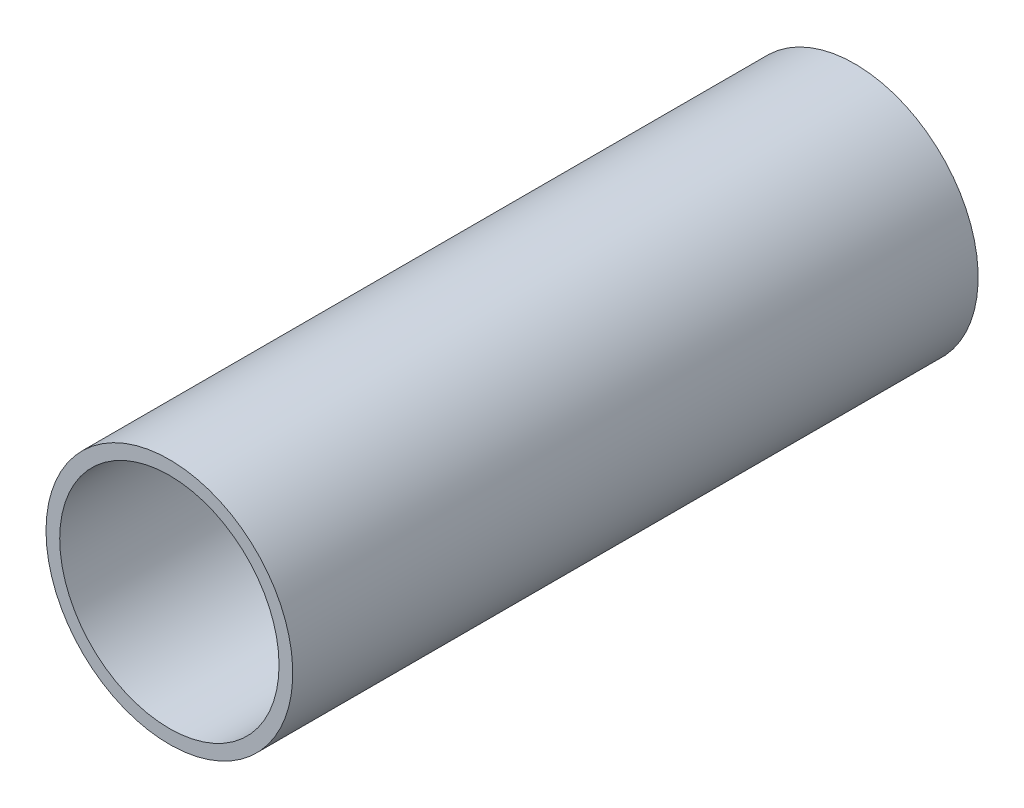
SolidWorks part; units mm, degrees
ref_plane "Face" through (0, 0, 0) normal (0, 0, 1) x (1, 0, 0)
ref_plane "Dessus" through (0, 0, 0) normal (0, 1, 0) x (1, 0, 0)
ref_plane "Droite" through (0, 0, 0) normal (1, 0, 0) x (0, 0, -1)
sketch "Esquisse1" plane through (0, 0, 0) normal (0, 0, 1) x (1, 0, 0)
  circle A0 centre (0, 0) radius 16
  circle A1 centre (0, 0) radius 18
  dimension "D1" = 32
  dimension "D2" = 36
extrude "Base-Extrusion" add sketch "Esquisse1" along normal blind 100
